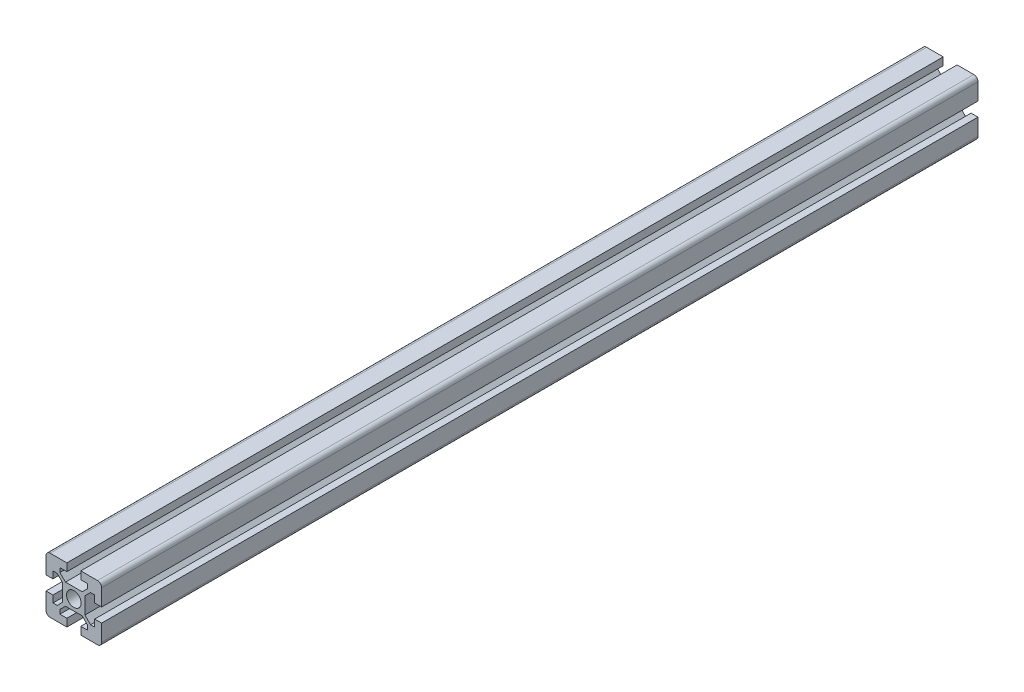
SolidWorks part; units mm, degrees
ref_plane "前基準面" through (0, 0, 0) normal (0, 0, 1) x (1, 0, 0)
ref_plane "上基準面" through (0, 0, 0) normal (0, 1, 0) x (1, 0, 0)
ref_plane "右基準面" through (0, 0, 0) normal (1, 0, 0) x (0, 0, -1)
sketch "草圖1" plane through (0, 0, 0) normal (0, 0, 1) x (1, 0, 0)
  line L0 (15, -5.5) -> (10, -5.5)
  line L1 (3, 0) -> (15, 0)
  line L2 (0, -3) -> (0, -15)
  line L3 (3, -40) -> (15, -40)
  line L4 (40, -3) -> (40, -15)
  line L5 (24.67, -40) -> (37, -40)
  line L6 (15, 0) -> (15, -5.5)
  line L7 (25, 0) -> (37, 0)
  line L8 (25, 0) -> (25, -5.5)
  line L9 (10, -5.5) -> (10, -8.5)
  line L10 (10, -8.5) -> (14, -12.5)
  line L11 (14, -12.5) -> (26, -12.5)
  line L12 (26, -12.5) -> (30, -8.5)
  line L13 (30, -8.5) -> (30, -5.5)
  line L14 (30, -5.5) -> (25, -5.5)
  line L17 (0, -25) -> (0, -37)
  line L18 (30, -34.5) -> (25, -34.5)
  line L19 (30, -31.5) -> (30, -34.5)
  line L20 (26, -27.5) -> (30, -31.5)
  line L21 (14, -27.5) -> (26, -27.5)
  line L22 (10, -31.5) -> (14, -27.5)
  line L23 (10, -34.5) -> (10, -31.5)
  line L24 (25, -40) -> (25, -34.5)
  line L25 (5, -15) -> (5, -10)
  line L26 (0, -15) -> (5, -15)
  line L27 (15, -40) -> (15, -34.5)
  line L28 (0, -25) -> (5, -25)
  line L29 (15, -34.5) -> (10, -34.5)
  line L30 (5, -10) -> (8, -10)
  line L31 (8, -10) -> (12, -14)
  line L32 (12, -14) -> (12, -26)
  line L33 (12, -26) -> (8, -30)
  line L34 (8, -30) -> (5, -30)
  line L35 (5, -30) -> (5, -25)
  line L36 (35, -30) -> (35, -25)
  line L37 (32, -30) -> (35, -30)
  line L38 (28, -26) -> (32, -30)
  line L39 (28, -14) -> (28, -26)
  line L40 (32, -10) -> (28, -14)
  line L41 (35, -10) -> (32, -10)
  line L42 (40, -25) -> (35, -25)
  line L43 (40, -15) -> (35, -15)
  line L44 (35, -15) -> (35, -10)
  line L45 (40, -25) -> (40, -37)
  circle A0 centre (20, -20) radius 5.25
  arc A1 (37, -40) -> (40, -37) centre (37, -37) ccw
  arc A2 (0, -37) -> (3, -40) centre (3, -37) ccw
  arc A3 (37, 0) -> (40, -3) centre (37, -3) cw
  arc A4 (3, 0) -> (0, -3) centre (3, -3) ccw
  point P52 (0, -40)
  point P55 (40, 0)
  point P58 (0, 0)
  dimension "D23" = 10.5
  dimension "D26" = 3
  dimension "D1" = 40
  dimension "D2" = 40
  dimension "D3" = 10
  dimension "D4" = 20
  dimension "D5" = 5
  dimension "D6" = 7
  dimension "D7" = 7
  dimension "D8" = 5.5
  dimension "D9" = 12
  dimension "D10" = 4
  dimension "D11" = 4
  dimension "D12" = 20
  dimension "D13" = 10
  dimension "D14" = 5
  dimension "D15" = 5
  dimension "D16" = 7
  dimension "D17" = 12
  dimension "D18" = 4
  dimension "D19" = 3
  dimension "D20" = 3
  dimension "D21" = 15
  dimension "D22" = 15
  dimension "D24" = 20
  dimension "D25" = 20
extrude "填料-伸長1" add sketch "草圖1" along normal blind 630 contours L1 A4 L2 L26 L25 L30 L31 L32 L33 L34 L35 L28 L17 A2 L3 L27 L29 L23 L22 L21 L20 L19 L18 L24 L5 A1 L45 L42 L36 L37 L38 L39 L40 L41 L44 L43 L4 A3 L7 L8 L14 L13 L12 L11 L10 L9 L0 L6 A0
